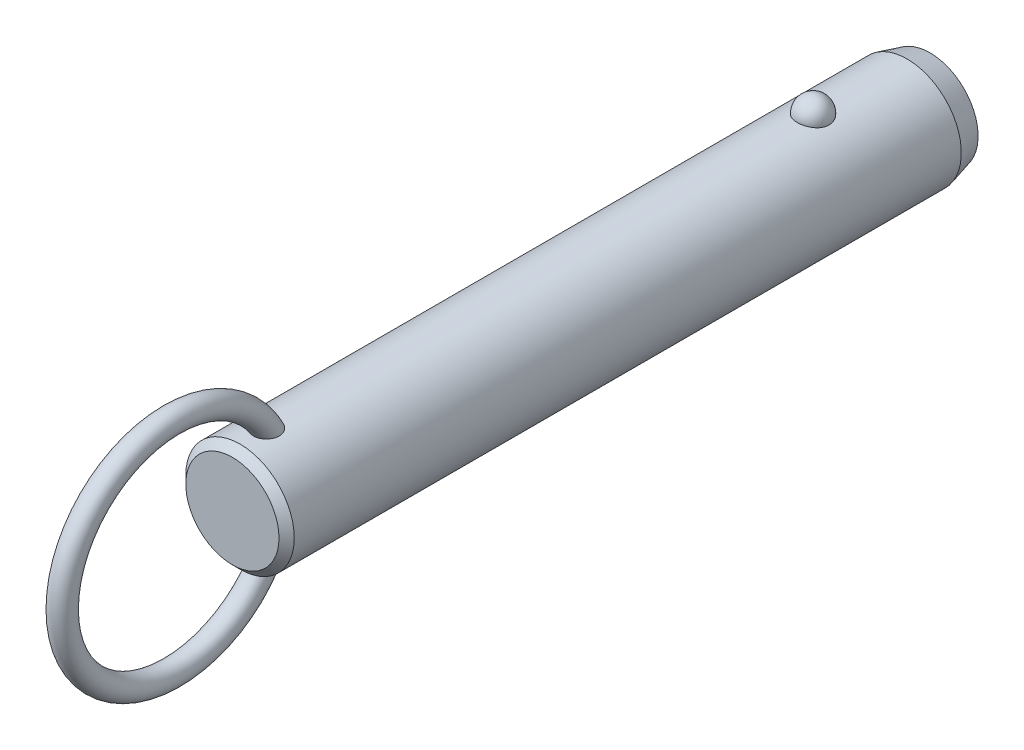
SolidWorks part; units mm, degrees
ref_plane "Front Plane" through (0, 0, 0) normal (0, 0, 1) x (1, 0, 0)
ref_plane "Top Plane" through (0, 0, 0) normal (0, 1, 0) x (1, 0, 0)
ref_plane "Right Plane" through (0, 0, 0) normal (1, 0, 0) x (0, 0, -1)
sketch "Sketch2" plane through (0, 0, 0) normal (0, 0, 1) x (1, 0, 0)
  circle A0 centre (0, 0) radius 7.1
  point P3 (0, 7.1)
  dimension "D1" = 14.2
extrude "Boss-Extrude1" add sketch "Sketch2" along normal blind 66
sketch "Sketch3" plane through (0, 0, 0) normal (0, 0, -1) x (-1, 0, 0)
  circle A0 centre (0, 0) radius 7.1
  dimension "D1" = 14.2
extrude "Boss-Extrude2" add sketch "Sketch3" along normal blind 17.4
chamfer "Chamfer1" distance 3 angle 15 1 edges at (-7.1, 0, -17.4)
sketch "Sketch12" plane through (0, 0, 0) normal (1, 0, 0) x (0, 0, -1)
  line L0 (-66, 7.1) -> (-66, -7.1) construction
  point P0 (-66, 0)
sketch "Sketch13" plane through (0, 0, 0) normal (1, 0, 0) x (0, 0, -1)
  circle A0 centre (-81.85, 0) radius 15.85
  point P2 (-66, 0)
  dimension "D1" = 31.7
sketch "Sketch14" plane through (0, 0, 0) normal (0, 1, 0) x (1, 0, 0)
  circle A0 centre (0, -67.5) radius 1.5
  point P2 (0, -66)
  dimension "D1" = 3
sweep "Sweep1" add profiles "Sketch14" path "Sketch13"
sketch "Sketch15" plane through (0, 0, 66) normal (0, 0, 1) x (1, 0, 0)
  circle A0 centre (0, 0) radius 7.1
  dimension "D1" = 14.2
extrude "Boss-Extrude3" add sketch "Sketch15" along normal blind 7.92
chamfer "Chamfer2" distance 1 angle 45 1 edges at (7.1, 0, 73.92)
sketch "Sketch18" plane through (0, 0, 0) normal (1, 0, 0) x (0, 0, -1)
  line L0 (14.4, 7.1) -> (-67.6792, 7.1) construction
  line L1 (2.1, 9.2) -> (2.1, 5)
  line L2 (-67.6792, -7.1) -> (14.4, -7.1) construction
  arc A0 (2.1, 9.2) -> (2.1, 5) centre (2.1, 7.1) ccw
  point P4 (0, 7.1)
  dimension "D1" = 16.3
revolve "Revolve1" add sketch "Sketch18" angle 360 about L1
